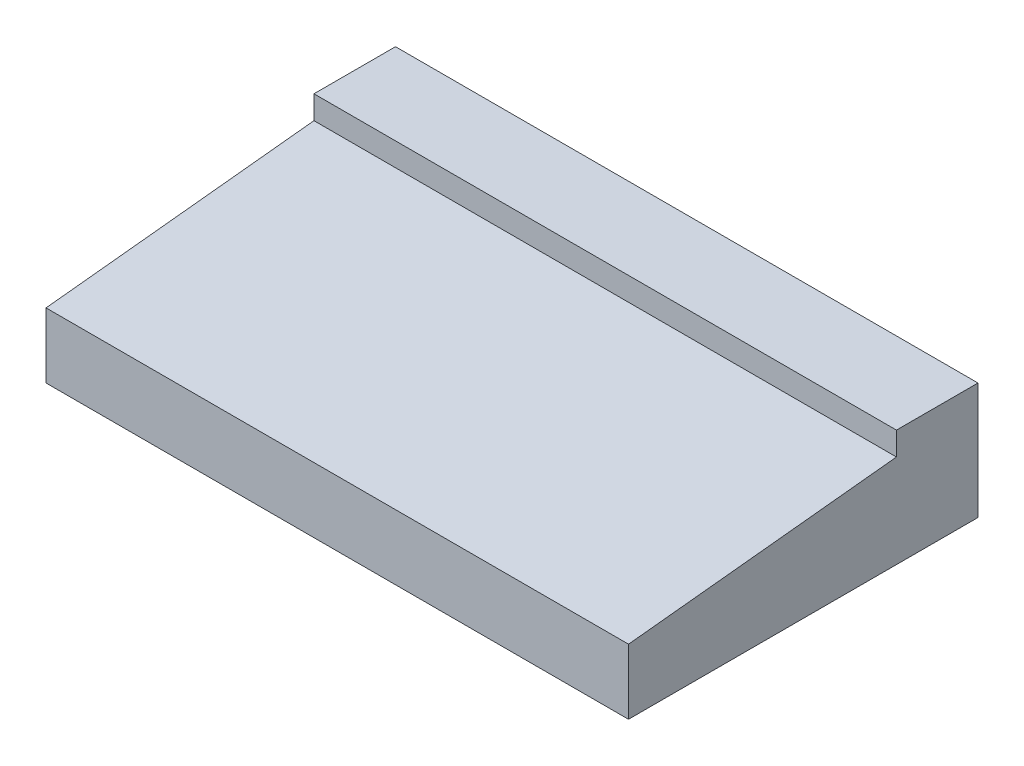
SolidWorks part; units mm, degrees
ref_plane "Plan de face" through (0, 0, 0) normal (0, 0, 1) x (1, 0, 0)
ref_plane "Plan de dessus" through (0, 0, 0) normal (0, 1, 0) x (1, 0, 0)
ref_plane "Plan de droite" through (0, 0, 0) normal (1, 0, 0) x (0, 0, -1)
sketch "Esquisse1" plane through (0, 0, 0) normal (1, 0, 0) x (0, 0, -1)
  line L0 (0, -3.6995) -> (0, 19.531) construction
  line L1 (-6.2478, 0) -> (36.6393, 0) construction
  line L2 (30, -3.6995) -> (30, 19.531) construction
  line L3 (23, 19.531) -> (23, 3.8312) construction
  line L4 (36.6393, 10) -> (-6.2478, 10) construction
  line L5 (-6.2478, 4) -> (10.5369, 4) construction
  line L6 (32.7462, 8) -> (21.6416, 8) construction
  line L7 (0, 0) -> (0.0029, 5.5829)
  line L8 (23, 8) -> (0.0029, 5.5829) construction
  line L9 (23, 8) -> (23, 10)
  line L10 (23, 10) -> (30, 10)
  line L11 (30, 10) -> (30, 0)
  line L12 (30, 0) -> (0, 0)
  line L13 (23, 8) -> (0.0029, 5.5829)
  dimension "D6" = 6
  dimension "D1" = 10
  dimension "D2" = 2
  dimension "D3" = 4
  dimension "D4" = 7
  dimension "D5" = 30
extrude "Extrusion1" add sketch "Esquisse1" along normal blind 50
